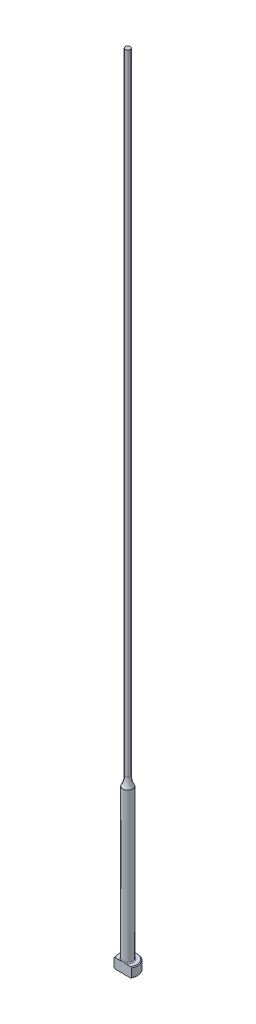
SolidWorks part; units mm, degrees
ref_plane "Front Plane" through (0, 0, 0) normal (0, 0, 1) x (1, 0, 0)
ref_plane "Top Plane" through (0, 0, 0) normal (0, 1, 0) x (1, 0, 0)
ref_plane "Right Plane" through (0, 0, 0) normal (1, 0, 0) x (0, 0, -1)
sketch "Sketch1" plane through (0, 0, 0) normal (0, 0, 1) x (1, 0, 0)
  line L0 (0, 259.9588) -> (0, -15.1925) construction
  line L1 (0, 0) -> (-3.175, 0)
  line L2 (-3.175, 0) -> (-3.175, 3.175)
  line L3 (-3.175, 3.175) -> (-1.5875, 3.175)
  line L4 (-0.7937, 53.8742) -> (-0.7937, 254)
  line L5 (-0.7937, 254) -> (0, 254)
  line L6 (0, 254) -> (0, 0)
  line L7 (-1.5875, 3.175) -> (-1.5875, 50.8)
  arc A0 (-1.5875, 50.8) -> (-0.7937, 53.8742) centre (-7.1437, 53.8742) ccw
  point P13 (-1.5875, 0)
  dimension "D1" = 6.35
  dimension "L" = 254
  dimension "D2" = 3.175
  dimension "H" = 6.35
  dimension "T" = 3.175
  dimension "D" = 1.5875
  dimension "S" = 50.8
revolve "Revolve1" add sketch "Sketch1" angle 360 about L0
chamfer "Chamfer1" distance 0.254 angle 45 2 edges at (0, 3.175, 3.175) (0, 0, 3.175)
fillet "Fillet1" radius 0.254 1 edges at (0, 3.175, 1.5875)
sketch "Sketch2" plane through (0, 0, 0) normal (0, -1, 0) x (1, 0, 0)
  line L0 (-2.7496, 1.5875) -> (2.7496, 1.5875)
  circle A0 centre (0, 0) radius 3.175 construction
  arc A1 (2.7496, 1.5875) -> (-2.7496, 1.5875) centre (0, 0) ccw
  circle A4 centre (0, 0) radius 1.5875 construction
  dimension "D1" = 0
extrude "KEY" cut sketch "Sketch2" against normal through all
